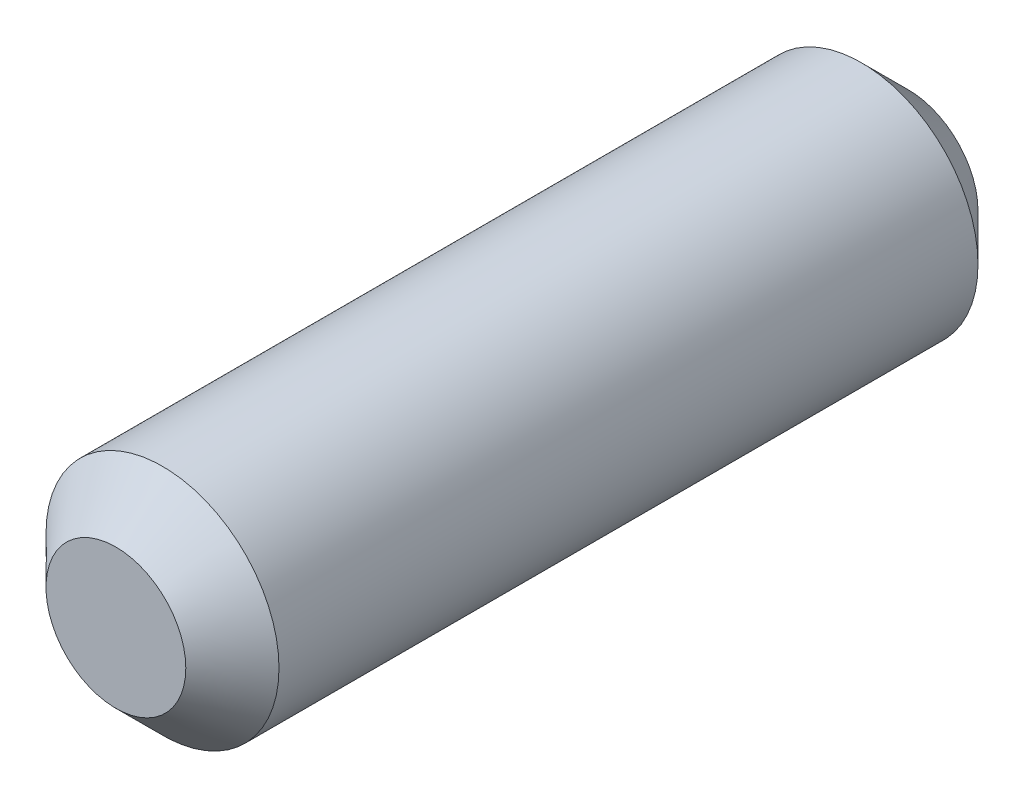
SolidWorks part; units mm, degrees
ref_plane "Front Plane" through (0, 0, 0) normal (0, 0, 1) x (1, 0, 0)
ref_plane "Top Plane" through (0, 0, 0) normal (0, 1, 0) x (1, 0, 0)
ref_plane "Right Plane" through (0, 0, 0) normal (1, 0, 0) x (0, 0, -1)
sketch "Sketch1" plane through (0, 0, 0) normal (0, 0, 1) x (1, 0, 0)
  circle A0 centre (-3.1438, 6.8287) radius 1.25 construction
  circle A1 centre (-3.1438, 6.8287) radius 1.25
extrude "Boss-Extrude1" add sketch "Sketch1" against normal blind 8.5
chamfer "Chamfer1" distance 0.5 angle 45 2 edges at (-1.8938, 6.8287, -8.5) (-1.8938, 6.8287, 0)
